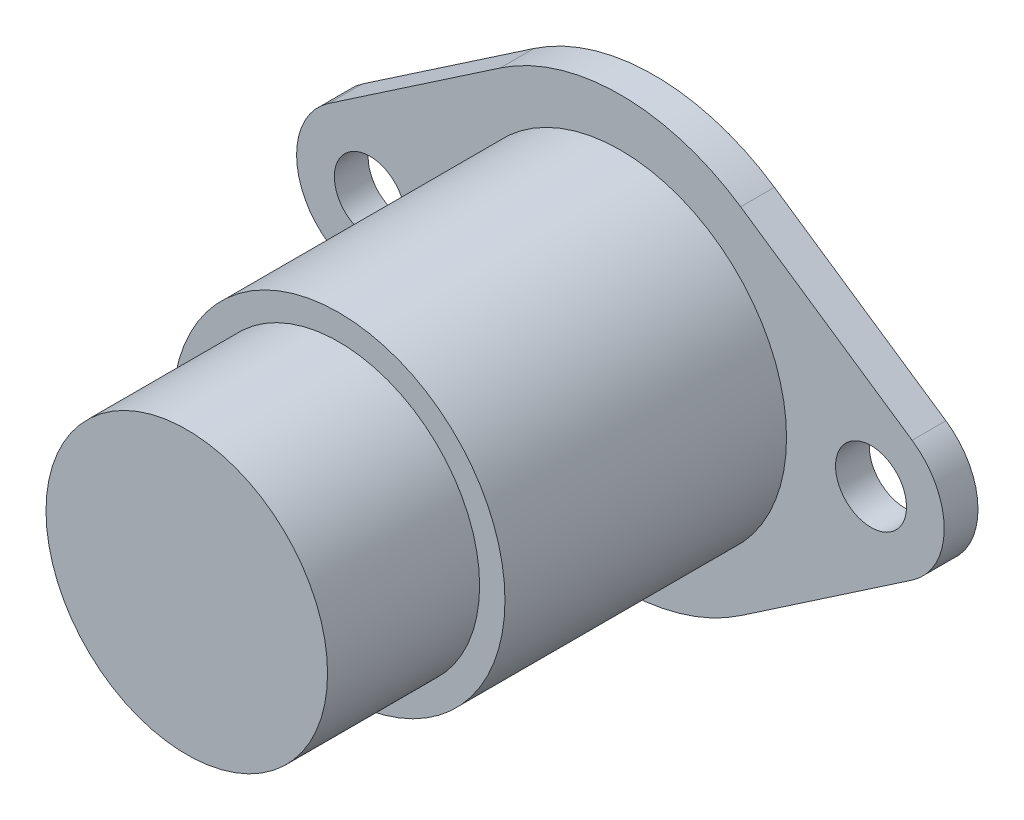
SolidWorks part; units mm, degrees
ref_plane "Front Plane" through (0, 0, 0) normal (0, 0, 1) x (1, 0, 0)
ref_plane "Top Plane" through (0, 0, 0) normal (0, 1, 0) x (1, 0, 0)
ref_plane "Right Plane" through (0, 0, 0) normal (1, 0, 0) x (0, 0, -1)
sketch "Sketch1" plane through (0, 0, 0) normal (0, 0, 1) x (1, 0, 0)
  line L0 (5.4225, 7.9849) -> (13.1581, 2.7317)
  line L1 (5.4225, -7.9849) -> (13.1581, -2.7317)
  line L2 (-5.4225, 7.9849) -> (-13.1581, 2.7317)
  line L3 (-5.4225, -7.9849) -> (-13.1581, -2.7317)
  arc A0 (-5.4225, 7.9849) -> (5.4225, 7.9849) centre (0, 0) cw
  arc A1 (5.4225, -7.9849) -> (-5.4225, -7.9849) centre (0, 0) cw
  arc A2 (-13.1581, 2.7317) -> (-13.1581, -2.7317) centre (-11.303, 0) ccw
  arc A5 (13.1581, -2.7317) -> (13.1581, 2.7317) centre (11.303, 0) ccw
extrude "Boss-Extrude1" add sketch "Sketch1" along normal blind 1.524
sketch "Sketch2" plane through (0, 0, 1.524) normal (0, 0, 1) x (1, 0, 0)
  circle A0 centre (0, 0) radius 7.493
extrude "Boss-Extrude2" add sketch "Sketch2" along normal blind 12.7
sketch "Sketch3" plane through (0, 0, 1.524) normal (0, 0, 1) x (1, 0, 0)
  circle A0 centre (-11.303, 0) radius 1.6002
  circle A1 centre (11.303, 0) radius 1.6002
extrude "Cut-Extrude1" cut sketch "Sketch3" against normal up to surface (1.524 mm away)
sketch "Sketch4" plane through (0, 0, 0) normal (0, 0, -1) x (-1, 0, 0)
  circle A0 centre (0, 0) radius 6.985
extrude "Cut-Extrude2" cut sketch "Sketch4" against normal blind 10.16
sketch "Sketch5" plane through (0, 0, 10.16) normal (0, 0, -1) x (-1, 0, 0)
  circle A0 centre (0, 0) radius 5.969
extrude "Boss-Extrude3" add sketch "Sketch5" along normal blind 9.906 separate body
sketch "Эскиз1" plane through (0, 0, 14.224) normal (0, 0, 1) x (1, 0, 0)
  circle A0 centre (0, 0) radius 6.35
extrude "Бобышка-Вытянуть1" add sketch "Эскиз1" along normal blind 6.858 separate body
